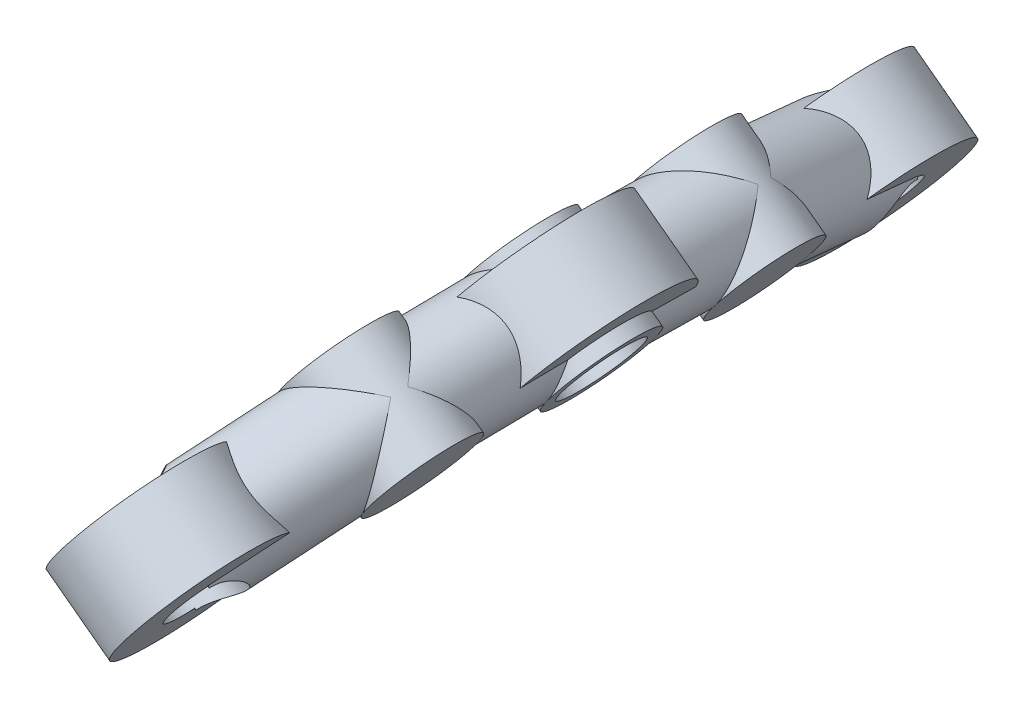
SolidWorks part; units mm, degrees
ref_plane "Alzado" through (0, 0, 0) normal (0, 0, 1) x (1, 0, 0)
ref_plane "Planta" through (0, 0, 0) normal (0, 1, 0) x (1, 0, 0)
ref_plane "Vista lateral" through (0, 0, 0) normal (1, 0, 0) x (0, 0, -1)
sketch3d "Sk_Arco_1"
  line L0 (-231.3637, 348.9396, -26) -> (-228.3681, 352.9429, -13)
  dimension "D1" = 13.9284
sweep "Arco_1" add path "Sk_Arco_1" parameters "D3"=8
sketch3d "Sk_Arco_2"
  line L0 (-228.3681, 352.9429, -13) -> (-227.769, 353.7435, 0)
  dimension "D1" = 13.0384
sweep "Arco_2" add path "Sk_Arco_2" parameters "D3"=8
sketch3d "Sk_Arco_3"
  line L0 (-227.769, 353.7435, 0) -> (-228.3681, 352.9429, 13)
  dimension "D1" = 13.0384
sweep "Arco_3" add path "Sk_Arco_3" parameters "D3"=8
sketch3d "Sk_Arco_4"
  line L0 (-228.3681, 352.9429, 13) -> (-231.3637, 348.9396, 26)
  dimension "D1" = 13.9284
sweep "Arco_4" add path "Sk_Arco_4" parameters "D3"=8
sketch3d "Sk_Arco_codo_1"
  line L0 (-225.1655, 350.5463, -13) -> (-231.5707, 355.3394, -13)
  dimension "D1" = 8
sweep "Arco_codo_1" add path "Sk_Arco_codo_1" parameters "D3"=8
sketch3d "Sk_Arco_codo_2"
  line L0 (-224.5664, 351.347, 0) -> (-230.9716, 356.14, 0)
  dimension "D1" = 8
sweep "Arco_codo_2" add path "Sk_Arco_codo_2" parameters "D3"=8
sketch3d "Sk_Arco_codo_3"
  line L0 (-225.1655, 350.5463, 13) -> (-231.5707, 355.3394, 13)
  dimension "D1" = 8
sweep "Arco_codo_3" add path "Sk_Arco_codo_3" parameters "D3"=8
sketch3d "Sk_Boss_izq"
  line L0 (-228.9618, 347.1422, -26) -> (-233.7657, 350.737, -26)
  dimension "D1" = 6
sweep "Boss_izq" add path "Sk_Boss_izq" parameters "D3"=12
sketch3d "Sk_Boss_dcho"
  line L0 (-228.9618, 347.1422, 26) -> (-233.7657, 350.737, 26)
  dimension "D1" = 6
sweep "Boss_dcho" add path "Sk_Boss_dcho" parameters "D3"=12
sketch3d "Sk_Boss_centro"
  line L0 (-225.367, 351.9461, 0) -> (-230.1709, 355.5409, 0)
  dimension "D1" = 6
sweep "Boss_centro" add path "Sk_Boss_centro" parameters "D3"=14
sketch3d "Sk_Pivote_izq"
  line L0 (-228.1611, 346.5431, -26) -> (-234.5664, 351.3361, -26)
  dimension "D1" = 8
sweep "Pivote_izq" cut path "Sk_Pivote_izq" parameters "D3"=5
sketch3d "Sk_Pivote_dcho"
  line L0 (-228.1611, 346.5431, 26) -> (-234.5664, 351.3361, 26)
  dimension "D1" = 8
sweep "Pivote_dcho" cut path "Sk_Pivote_dcho" parameters "D3"=5
sketch3d "Sk_Taladro_tornillo"
  line L0 (-224.5664, 351.347, 0) -> (-230.9716, 356.14, 0)
  dimension "D1" = 8
sweep "Taladro_tornillo" cut path "Sk_Taladro_tornillo" parameters "D3"=6
